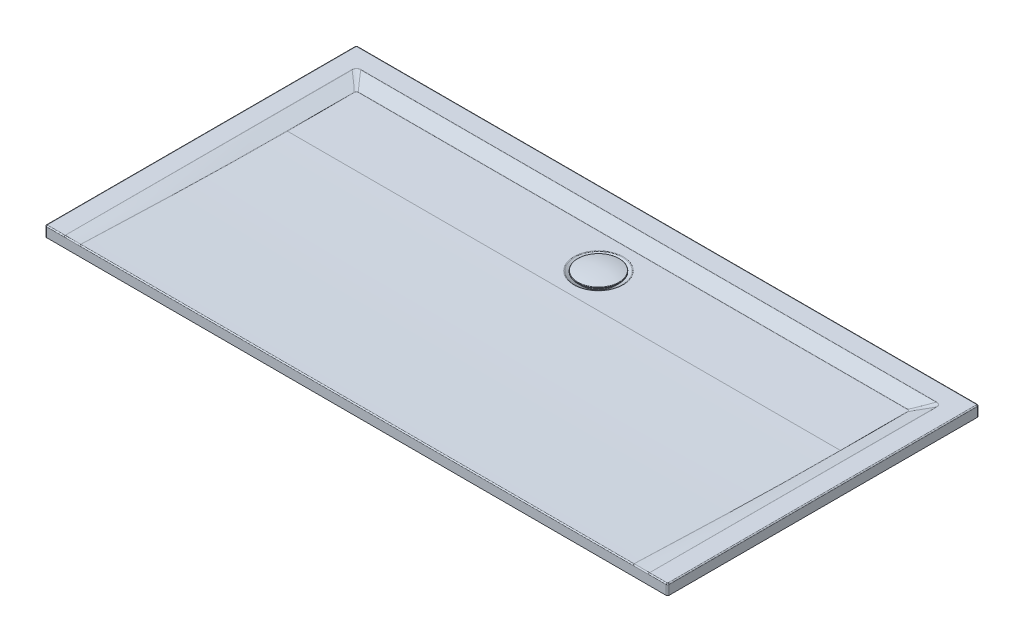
SolidWorks part; units mm, degrees
ref_plane "Płaszczyzna przednia" through (0, 0, 0) normal (0, 0, 1) x (1, 0, 0)
ref_plane "Płaszczyzna górna" through (0, 0, 0) normal (0, 1, 0) x (1, 0, 0)
ref_plane "Płaszczyzna prawa" through (0, 0, 0) normal (1, 0, 0) x (0, 0, -1)
sketch "Szkic1" plane through (0, 0, 0) normal (0, 1, 0) x (1, 0, 0)
  line L0 (0, 450) -> (0, -450) construction
  line L1 (-900, 450) -> (900, 450)
  line L2 (-900, 450) -> (-900, -450)
  line L3 (-900, -450) -> (900, -450)
  line L4 (900, 450) -> (900, -450)
  line L5 (-845, -450) -> (-845, 395)
  line L6 (-845, 395) -> (845, 395)
  line L7 (845, 395) -> (845, -450)
  line L8 (-800, -450) -> (-800, 350)
  line L9 (-800, 350) -> (800, 350)
  line L10 (800, 350) -> (800, -450)
  circle A0 centre (0, 250) radius 45
  circle A1 centre (0, 250) radius 70
  point P9 (0, 395)
  dimension "D6" = 90
  dimension "D7" = 140
  dimension "D1" = 1800
  dimension "D2" = 55
  dimension "D3" = 55
  dimension "D5" = 200
  dimension "D8" = 900
  dimension "D4" = 45
sketch "Szkic2" plane through (0, 0, 0) normal (0, 1, 0) x (1, 0, 0)
  line L0 (-900, -450) -> (900, -450) construction
  line L1 (900, 450) -> (900, -450) construction
  line L2 (845, 395) -> (845, -450) construction
  line L3 (-845, 395) -> (845, 395) construction
  line L4 (-900, 450) -> (900, 450) construction
  line L5 (-845, -450) -> (-845, 395) construction
  line L6 (-900, 450) -> (-900, -450) construction
  line L7 (-900, -450) -> (-845, -450)
  line L8 (900, 450) -> (900, -450)
  line L9 (845, 395) -> (845, -450)
  line L10 (-845, 395) -> (845, 395)
  line L11 (-900, 450) -> (900, 450)
  line L12 (-845, -450) -> (-845, 395)
  line L13 (-900, 450) -> (-900, -450)
  line L14 (845, -450) -> (900, -450)
surface "Powierzchnia-Płaszczyzna1" sketch "Szkic2"
ref_plane "Płaszczyzna1" through (0, -15, 0) normal (0, 1, 0) x (-1, 0, 0)
sketch "Szkic3" plane through (0, -15, 0) normal (0, 1, 0) x (-1, 0, 0)
  line L0 (800, -150) -> (-800, -150)
  line L1 (800, 450) -> (800, -350) construction
  line L2 (-800, -350) -> (-800, 450) construction
  line L3 (0, -150) -> (0, -350) construction
  line L4 (800, -350) -> (-800, -350) construction
  line L5 (-800, -350) -> (-800, -150)
  line L6 (800, -150) -> (800, -350)
  line L7 (800, -350) -> (-800, -350)
  circle A0 centre (0, -250) radius 70 construction
  circle A1 centre (0, -250) radius 70
  point P10 (0, -250)
surface "Powierzchnia-Płaszczyzna2" sketch "Szkic3"
sketch "Szkic4" plane through (0, 0, 0) normal (0, 1, 0) x (1, 0, 0)
  line L0 (800, -450) -> (-800, -450)
other "Granica-Powierzchnia1"
other "Granica-Powierzchnia2"
other "Granica-Powierzchnia3"
mirror "Lustro1" about plane through (0, 0, 0) normal (1, 0, 0)
sketch "Szkic5" plane through (0, 0, 0) normal (0, 1, 0) x (1, 0, 0)
  line L0 (900, 450) -> (900, -450) construction
  line L1 (-900, 450) -> (900, 450) construction
  line L2 (-900, 450) -> (-900, -450) construction
  line L3 (-900, -450) -> (900, -450) construction
  line L4 (900, 450) -> (900, -450)
  line L5 (-900, 450) -> (900, 450)
  line L6 (-900, 450) -> (-900, -450)
  line L7 (-900, -450) -> (900, -450)
surface "Powierzchnia-Wyciągnięcie1" sketch "Szkic5" parameters "D1"=30
sketch "Szkic7" plane through (0, 0, 0) normal (1, 0, 0) x (0, 0, -1)
  line L0 (250, 0) -> (250, -30) construction
  line L1 (450, -30) -> (-450, -30) construction
  line L2 (295, -30) -> (295, -28)
  line L3 (295, -28) -> (299, -28)
  line L6 (299, -28) -> (320, -15)
  dimension "D1" = 90
  dimension "D2" = 2
  dimension "D3" = 98
surface "Powierzchnia-Obrót wokół linii środkowej1" sketch "Szkic7" parameters "D1"=360
surface "Powierzchnia-Płaszczyzna3"
surface "Powierzchnia-Połącz1"
fillet "Zaokrąglenie1" radius 4 6 edges at (0, -28, -299) (0, -15, -180) (900, -15, 450) (900, -15, -450) (-900, -15, -450) (-900, -15, 450)
fillet "Zmienne zaokrąglenie1" radius 40 2 edges at (822.5, -7.5, -372.5)
fillet "Zaokrąglenie3" radius 3 12 edges
fillet "Zaokrąglenie4" radius 3 12 edges at (-898.8284, 0, -448.8284) (0, 0, -450) (898.8284, 0, -448.8284) (900, 0, 0) (898.8284, 0, 448.8284) (870.5, 0, 450) (-870.5, 0, 450) (-898.8284, 0, 448.8284) (-900, 0, 0)
sketch "Szkic8" plane through (0, 0, 0) normal (1, 0, 0) x (0, 0, -1)
  line L0 (250, 0) -> (250, -30) construction
  line L1 (250, -5.6601) -> (179.8469, -5.6601) construction
  line L2 (310, -14.7573) -> (310, -17)
  line L3 (310, -17) -> (250, -17)
  line L4 (250, -17) -> (250, -5.6601)
  line L5 (250, -5.6601) -> (199.9922, 95.6514)
  arc A0 (250, -5.6601) -> (309.2694, -13.7943) centre (250, -225.6601) cw
  arc A1 (309.2694, -13.7943) -> (310, -14.7573) centre (309, -14.7573) cw
  point P11 (310, -14)
  dimension "D1" = 220
  dimension "D4" = 1
  dimension "D2" = 60
  dimension "D3" = 3
  dimension "D5" = 13
revolve "Obrót wokół linii środkowej1" add sketch "Szkic8" angle 360 about L4
